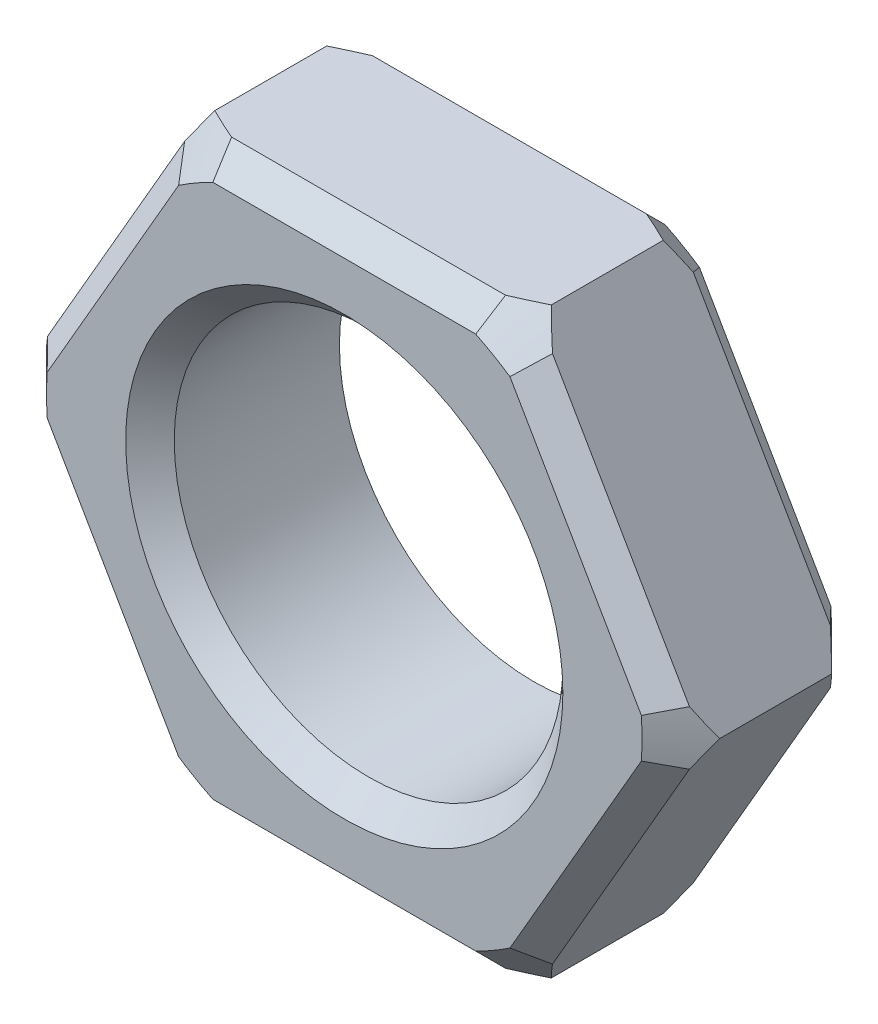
SolidWorks part; units mm, degrees
ref_plane "Спереди" through (0, 0, 0) normal (0, 0, 1) x (1, 0, 0)
ref_plane "Сверху" through (0, 0, 0) normal (0, 1, 0) x (1, 0, 0)
ref_plane "Справа" through (0, 0, 0) normal (1, 0, 0) x (0, 0, -1)
sketch "Эскиз1" plane through (0, 0, 0) normal (0, 0, 1) x (1, 0, 0)
  line L1 (-6.9282, -12) -> (6.9282, -12)
  line L2 (6.9282, -12) -> (13.8564, 0)
  line L3 (13.8564, 0) -> (6.9282, 12)
  line L4 (6.9282, 12) -> (-6.9282, 12)
  line L5 (-6.9282, 12) -> (-13.8564, 0)
  line L6 (-13.8564, 0) -> (-6.9282, -12)
  circle A0 centre (0, 0) radius 12 construction
  circle A1 centre (0, 0) radius 8
  dimension "D1" = 24
  dimension "D2" = 16
extrude "Бобышка-Вытянуть1" add sketch "Эскиз1" along normal blind 7.8
chamfer "Фаска1" distance 1 angle 45 13 edges at (0, -12, 0) (10.3923, -6, 0) (10.3923, 6, 0) (0, 12, 0) (-10.3923, 6, 0) (-10.3923, -6, 0) (8, 0, 7.8) (-10.3923, 6, 7.8) (0, 12, 7.8) (10.3923, 6, 7.8) (10.3923, -6, 7.8) (0, -12, 7.8) (-10.3923, -6, 7.8)
sketch "Эскиз2" plane through (0, 0, 0) normal (0, 1, 0) x (1, 0, 0)
  line L0 (-11.3627, 0.8964) -> (-14.2591, -2)
  line L1 (-14.2591, -2) -> (-14.2591, -5.8)
  line L2 (-14.2591, -5.8) -> (-11.6153, -8.4438)
  line L3 (-11.6153, -8.4438) -> (-16.6988, -8.4438)
  line L4 (-16.6988, -8.4438) -> (-16.6988, 0.8964)
  line L5 (-16.6988, 0.8964) -> (-11.3627, 0.8964)
  line L6 (-6.3509, -7.8) -> (-12.7017, -7.8) construction
  line L7 (-12.7017, 0) -> (-6.3509, 0) construction
  line L8 (0, 2.1899) -> (0, -8.9342) construction
  dimension "D1" = 45
  dimension "D2" = 45
  dimension "D3" = 2
  dimension "D4" = 2
revolve "Вырез-Повернуть1" cut sketch "Эскиз2" angle 360 about L8
